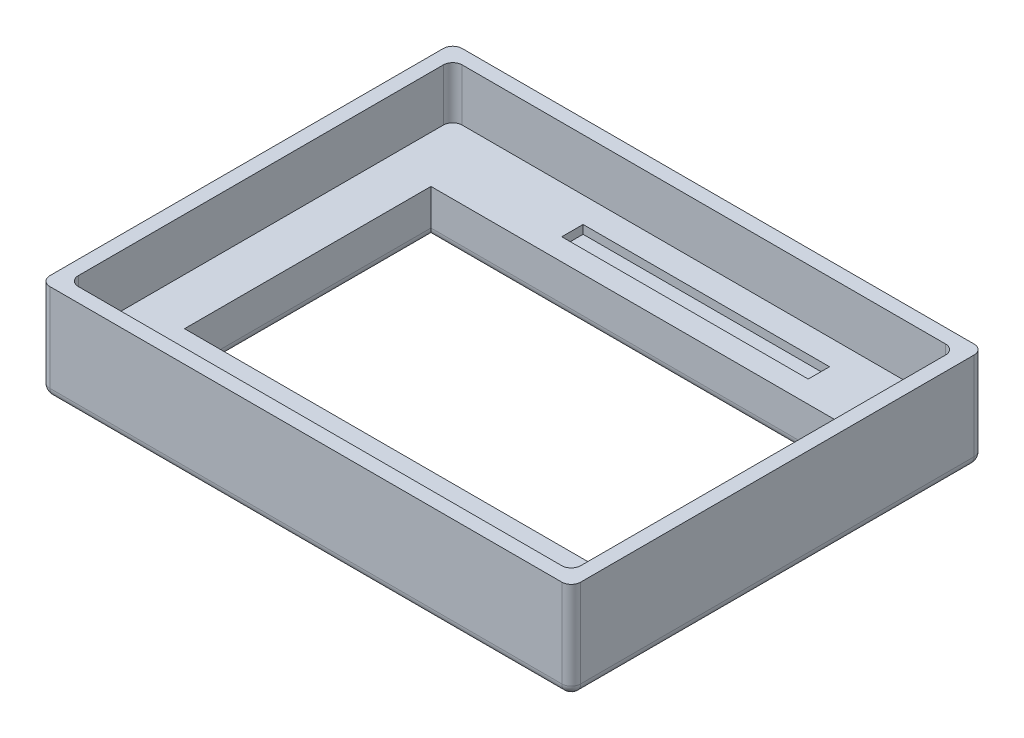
SolidWorks part; units mm, degrees
ref_plane "Front Plane" through (0, 0, 0) normal (0, 0, 1) x (1, 0, 0)
ref_plane "Top Plane" through (0, 0, 0) normal (0, 1, 0) x (1, 0, 0)
ref_plane "Right Plane" through (0, 0, 0) normal (1, 0, 0) x (0, 0, -1)
sketch "Sketch2" plane through (0, 0, 0) normal (0, 1, 0) x (1, 0, 0)
  line L1 (-47.2183, 24.7381) -> (58.7817, 24.7381)
  line L2 (-47.2183, 24.7381) -> (-47.2183, -56.2619)
  line L3 (-47.2183, -56.2619) -> (58.7817, -56.2619)
  line L4 (58.7817, 24.7381) -> (58.7817, -56.2619)
  dimension "D1" = 106
  dimension "D2" = 81
extrude "Boss-Extrude1" add sketch "Sketch2" along normal blind 9.6
sketch "Sketch4" plane through (0, 9.6, 0) normal (0, 1, 0) x (1, 0, 0)
  line L0 (58.7817, -56.2619) -> (58.7817, 24.7381) construction
  line L1 (-40.8183, 19.2381) -> (52.1817, 19.2381) construction
  line L2 (-40.8183, 19.2381) -> (-40.8183, -50.7619) construction
  line L3 (-40.8183, -50.7619) -> (52.1817, -50.7619) construction
  line L4 (52.1817, 19.2381) -> (52.1817, -50.7619) construction
  line L5 (-47.2183, -56.2619) -> (58.7817, -56.2619) construction
  dimension "D1" = 93
  dimension "D2" = 70
  dimension "D3" = 6.6
  dimension "D4" = 5.5
sketch "Sketch5" plane through (0, 9.6, 0) normal (0, 1, 0) x (1, 0, 0)
  line L0 (-40.8183, 19.2381) -> (52.1817, 19.2381) construction
  line L1 (-37.3183, 10.2381) -> (48.7817, 10.2381)
  line L2 (-37.3183, 10.2381) -> (-37.3183, -41.7619)
  line L3 (-37.3183, -41.7619) -> (48.7817, -41.7619)
  line L4 (48.7817, 10.2381) -> (48.7817, -41.7619)
  line L5 (-40.8183, -50.7619) -> (52.1817, -50.7619) construction
  line L6 (-40.8183, 19.2381) -> (-40.8183, -50.7619) construction
  line L8 (52.1817, 19.2381) -> (52.1817, -50.7619) construction
  dimension "D1" = 3.4
  dimension "D2" = 9
  dimension "D3" = 9
  dimension "D4" = 52
  dimension "D5" = 3.5
  dimension "D6" = 86.1
extrude "Cut-Extrude1" cut sketch "Sketch5" against normal through all
sketch "Sketch6" plane through (0, 9.6, 0) normal (0, 1, 0) x (1, 0, 0)
  line L0 (48.7817, 10.2381) -> (-37.3183, 10.2381) construction
  line L3 (-14.3183, 19.3381) -> (37.6817, 19.3381)
  line L4 (-14.3183, 19.3381) -> (-14.3183, 14.8381)
  line L5 (-14.3183, 14.8381) -> (37.6817, 14.8381)
  line L6 (37.6817, 19.3381) -> (37.6817, 14.8381)
  dimension "D1" = 52
  dimension "D2" = 4.5
  dimension "D3" = 4.6
  dimension "D4" = 26.5
extrude "Cut-Extrude2" cut sketch "Sketch6" against normal blind 1.8
sketch "Sketch7" plane through (0, 9.6, 0) normal (0, 1, 0) x (1, 0, 0)
  line L1 (-47.2183, 24.7381) -> (-50.2183, 24.7381)
  line L2 (-47.2183, 24.7381) -> (-47.2183, -56.2619)
  line L3 (-47.2183, -56.2619) -> (-50.2183, -56.2619)
  line L4 (-50.2183, 24.7381) -> (-50.2183, -56.2619)
  line L5 (58.7817, 24.7381) -> (61.7817, 24.7381)
  line L6 (58.7817, 24.7381) -> (58.7817, -56.2619)
  line L7 (58.7817, -56.2619) -> (61.7817, -56.2619)
  line L8 (61.7817, 24.7381) -> (61.7817, -56.2619)
  dimension "D1" = 3
  dimension "D2" = 3
extrude "Boss-Extrude2" add sketch "Sketch7" against normal blind 9.6 and the other way blind 11
sketch "Sketch8" plane through (0, 0, 0) normal (0, -1, 0) x (-1, 0, 0)
  line L1 (-61.7817, 24.7381) -> (50.2183, 24.7381)
  line L2 (-61.7817, 24.7381) -> (-61.7817, 27.7381)
  line L3 (-61.7817, 27.7381) -> (50.2183, 27.7381)
  line L4 (50.2183, 24.7381) -> (50.2183, 27.7381)
  line L5 (-61.7817, -56.2619) -> (50.2183, -56.2619)
  line L6 (-61.7817, -56.2619) -> (-61.7817, -59.2619)
  line L7 (-61.7817, -59.2619) -> (50.2183, -59.2619)
  line L8 (50.2183, -56.2619) -> (50.2183, -59.2619)
  dimension "D1" = 3
  dimension "D2" = 3
extrude "Boss-Extrude3" add sketch "Sketch8" against normal blind 20.6
fillet "Fillet1" radius 2 12 edges at (5.7817, 0, -27.7381) (-50.2183, 0, 15.7619) (5.7817, 0, 59.2619) (61.7817, 0, 15.7619) (48.7817, 0, 15.7619) (5.7317, 0, 41.7619) (-37.3183, 0, 15.7619) (5.7317, 0, -10.2381) (61.7817, 10.3, 59.2619) (61.7817, 10.3, -27.7381) (-50.2183, 10.3, -27.7381) (-50.2183, 10.3, 59.2619)
fillet "Fillet2" radius 2 4 edges
